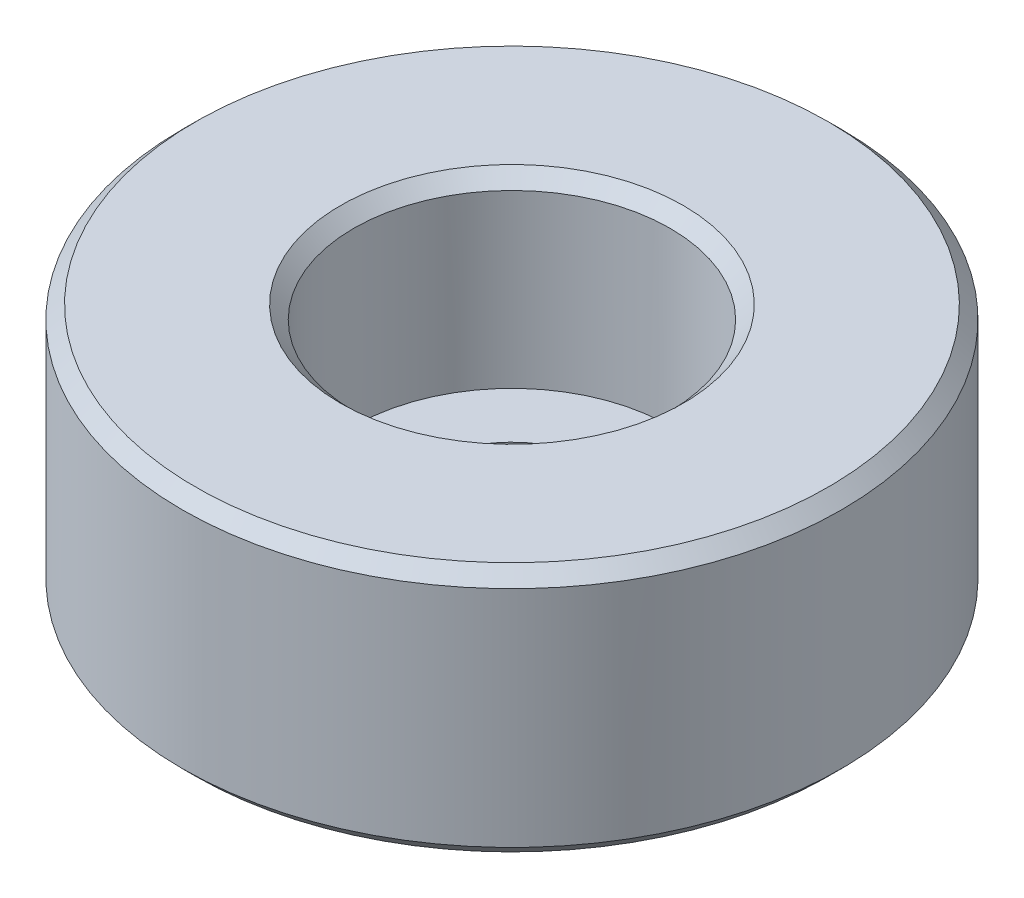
SolidWorks part; units mm, degrees
ref_plane "Plan1" through (0, 0, 0) normal (0, 0, 1) x (1, 0, 0)
ref_plane "Plan2" through (0, 0, 0) normal (0, 1, 0) x (1, 0, 0)
ref_plane "Plan3" through (0, 0, 0) normal (1, 0, 0) x (0, 0, -1)
sketch "Esquisse1" plane through (0, 0, 0) normal (0, 0, 1) x (1, 0, 0)
  line L0 (0, 50) -> (0, -20) construction
  line L1 (12.5, 0) -> (12.5, 9.5)
  line L2 (12.5, 9.5) -> (6, 9.5)
  line L3 (6, 9.5) -> (6, 2.5)
  line L4 (3.5, -4) -> (3.5, 2.5)
  line L5 (3.5, 2.5) -> (6, 2.5)
  line L6 (3.5, -4) -> (6, -4)
  line L12 (6, -4) -> (6, 0)
  line L13 (6, 0) -> (12.5, 0)
  dimension "D1" = 3.5
  dimension "D2" = 6
  dimension "D3" = 6
  dimension "D4" = 4
  dimension "D5" = 9.5
  dimension "D6" = 7
  dimension "D7" = 12.5
revolve "Base-Révolution" add sketch "Esquisse1" angle 360 about L0
chamfer "Chanfrein1" distance 0.5 angle 45
